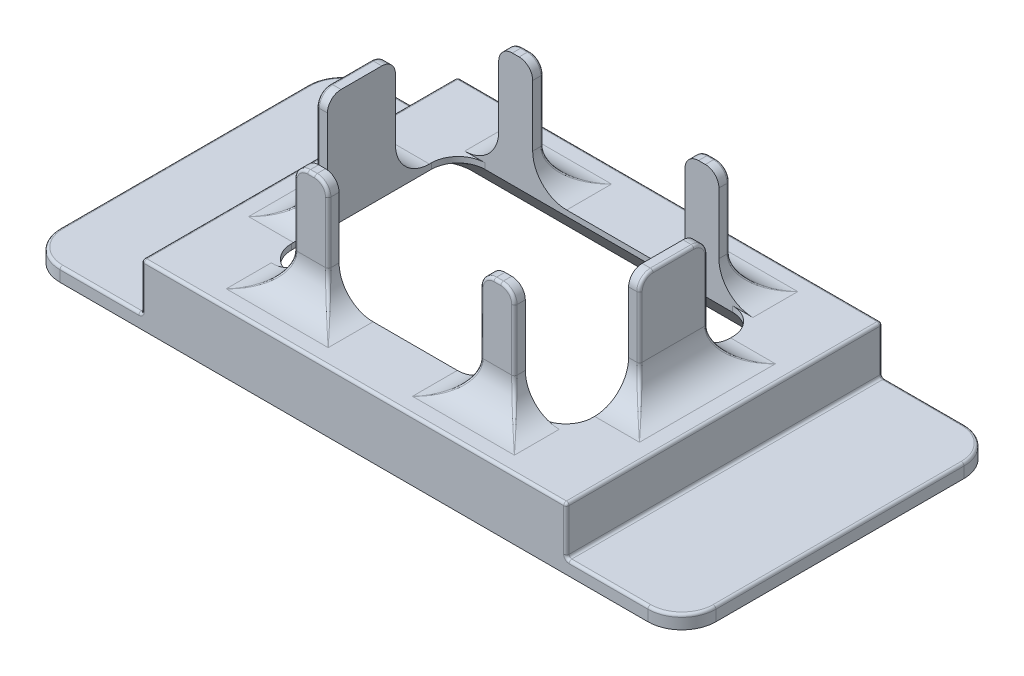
SolidWorks part; units mm, degrees
ref_plane "Front Plane" through (0, 0, 0) normal (0, 0, 1) x (1, 0, 0)
ref_plane "Top Plane" through (0, 0, 0) normal (0, 1, 0) x (1, 0, 0)
ref_plane "Right Plane" through (0, 0, 0) normal (1, 0, 0) x (0, 0, -1)
sketch "Sketch1" plane through (0, 0, 0) normal (0, 1, 0) x (1, 0, 0)
  line L1 (0, 0) -> (117.475, 0) construction
  line L2 (0, 0) -> (0, 53.975) construction
  line L3 (0, 53.975) -> (117.475, 53.975) construction
  line L4 (117.475, 0) -> (117.475, 53.975) construction
  line L13 (-2.54, -2.54) -> (120.015, -2.54)
  line L14 (-2.54, -2.54) -> (-2.54, 56.515)
  line L15 (-2.54, 56.515) -> (120.015, 56.515)
  line L16 (120.015, -2.54) -> (120.015, 56.515)
  point P5 (0, 0)
  point P6 (0, 0)
  dimension "D1" = 53.975
  dimension "D2" = 117.475
extrude "Boss-Extrude1" add sketch "Sketch1" along normal blind 2.54
sketch "Sketch4" plane through (0, 2.54, 0) normal (0, 1, 0) x (1, 0, 0)
  line L0 (120.015, 56.515) -> (-2.54, 56.515) construction
  line L1 (19.05, 56.515) -> (98.425, 56.515)
  line L2 (19.05, 56.515) -> (19.05, -2.54)
  line L3 (19.05, -2.54) -> (98.425, -2.54)
  line L4 (98.425, 56.515) -> (98.425, -2.54)
  line L5 (-2.54, -2.54) -> (120.015, -2.54) construction
  line L6 (19.05, 31.2477) -> (-2.54, 31.2477) construction
  line L7 (-2.54, 56.515) -> (-2.54, -2.54) construction
  line L8 (98.425, 33.5553) -> (120.015, 33.5553) construction
  line L9 (120.015, -2.54) -> (120.015, 56.515) construction
ref_plane "Plane1" through (0, 8.89, 0) normal (0, 1, 0) x (1, 0, 0)
extrude "Boss-Extrude4" add sketch "Sketch4" along normal blind 8.89
sketch "Sketch2" plane through (0, 11.43, 0) normal (0, 1, 0) x (1, 0, 0)
  line L0 (36.7804, 44.1713) -> (80.6946, 44.1713)
  line L17 (36.7804, 39.398) -> (80.6946, 39.398) construction
  line L18 (36.7804, 39.398) -> (36.7804, 14.577) construction
  line L19 (36.7804, 14.577) -> (80.6946, 14.577) construction
  line L20 (80.6946, 39.398) -> (80.6946, 14.577) construction
  line L22 (85.4678, 39.398) -> (85.4678, 14.577)
  line L23 (80.6946, 9.8037) -> (36.7804, 9.8037)
  line L25 (32.0072, 39.398) -> (32.0072, 14.577)
  line L28 (46.4988, 45.1675) -> (46.4988, 56.515) construction
  line L30 (19.05, 56.515) -> (98.425, 56.515) construction
  line L32 (46.0263, 8.8075) -> (46.0263, -2.54) construction
  line L34 (19.05, -2.54) -> (98.425, -2.54) construction
  line L39 (30.4575, 31.1755) -> (-2.54, 31.1755) construction
  line L40 (-2.54, 56.515) -> (-2.54, -2.54) construction
  line L41 (87.0175, 32.6858) -> (120.015, 32.6858) construction
  line L42 (120.015, -2.54) -> (120.015, 56.515) construction
  line L43 (36.7804, 14.577) -> (80.6946, 39.398) construction
  line L44 (36.7804, 39.398) -> (80.6946, 14.577) construction
  arc A4 (36.7804, 44.1713) -> (32.0072, 39.398) centre (36.7804, 39.398) ccw
  arc A5 (32.0072, 14.577) -> (36.7804, 9.8037) centre (36.7804, 14.577) ccw
  arc A6 (80.6946, 9.8037) -> (85.4678, 14.577) centre (80.6946, 14.577) ccw
  arc A7 (85.4678, 39.398) -> (80.6946, 44.1713) centre (80.6946, 39.398) ccw
sketch "Sketch6" plane through (0, 0, 0) normal (0, 1, 0) x (1, 0, 0)
  line L0 (24.2375, 53.9875) -> (93.2375, 53.9875)
  line L1 (24.2375, 46.4875) -> (93.2375, 46.4875) construction
  line L2 (24.2375, 46.4875) -> (24.2375, 7.4875) construction
  line L3 (24.2375, 7.4875) -> (93.2375, 7.4875) construction
  line L4 (93.2375, 46.4875) -> (93.2375, 7.4875) construction
  line L5 (100.7375, 46.4875) -> (100.7375, 7.4875)
  line L6 (93.2375, -0.0125) -> (24.2375, -0.0125)
  line L7 (16.7375, 46.4875) -> (16.7375, 7.4875)
  line L8 (24.2375, 7.4875) -> (93.2375, 46.4875) construction
  line L9 (24.2375, 46.4875) -> (93.2375, 7.4875) construction
  line L10 (48.6453, 53.9875) -> (48.6453, 56.515) construction
  line L11 (19.05, 56.515) -> (98.425, 56.515) construction
  line L12 (47.9303, -0.0125) -> (47.9303, -2.54) construction
  line L13 (19.05, -2.54) -> (98.425, -2.54) construction
  line L14 (16.7375, 28.6337) -> (-2.54, 28.6337) construction
  line L15 (-2.54, 56.515) -> (-2.54, -2.54) construction
  line L16 (100.7375, 24.0221) -> (120.015, 24.0221) construction
  line L17 (120.015, -2.54) -> (120.015, 56.515) construction
  arc A0 (24.2375, 53.9875) -> (16.7375, 46.4875) centre (24.2375, 46.4875) ccw
  arc A1 (16.7375, 7.4875) -> (24.2375, -0.0125) centre (24.2375, 7.4875) ccw
  arc A2 (93.2375, -0.0125) -> (100.7375, 7.4875) centre (93.2375, 7.4875) ccw
  arc A3 (100.7375, 46.4875) -> (93.2375, 53.9875) centre (93.2375, 46.4875) ccw
  dimension "D3" = 7.5
  dimension "D1" = 39
  dimension "D2" = 69
loft "Cut-Loft2" cut profiles "Sketch2", "Sketch6"
sketch "Sketch8" plane through (0, 11.43, 0) normal (0, 1, 0) x (1, 0, 0)
  line L0 (35.6248, 45.0757) -> (81.8502, 45.0757)
  line L1 (35.6248, 40.0512) -> (81.8502, 40.0512) construction
  line L2 (35.6248, 40.0512) -> (35.6248, 13.9238) construction
  line L3 (35.6248, 13.9238) -> (81.8502, 13.9238) construction
  line L4 (81.8502, 40.0512) -> (81.8502, 13.9238) construction
  line L5 (86.8747, 40.0512) -> (86.8747, 13.9238)
  line L6 (81.8502, 8.8993) -> (35.6248, 8.8993)
  line L7 (30.6003, 40.0512) -> (30.6003, 13.9238)
  line L8 (35.6248, 13.9238) -> (81.8502, 40.0512) construction
  line L9 (35.6248, 40.0512) -> (81.8502, 13.9238) construction
  line L10 (53.9536, 45.0757) -> (53.9536, 56.515) construction
  line L11 (98.425, 56.515) -> (19.05, 56.515) construction
  line L12 (53.9536, 8.8993) -> (53.9536, -2.54) construction
  line L13 (19.05, -2.54) -> (98.425, -2.54) construction
  line L14 (30.6003, 28.5496) -> (-2.54, 28.5496) construction
  line L16 (-2.54, 56.515) -> (-2.54, -2.54) construction
  line L18 (86.8747, 29.6235) -> (120.015, 29.6235) construction
  line L19 (120.015, -2.54) -> (120.015, 56.515) construction
  arc A0 (35.6248, 45.0757) -> (30.6003, 40.0512) centre (35.6248, 40.0512) ccw
  arc A1 (30.6003, 13.9238) -> (35.6248, 8.8993) centre (35.6248, 13.9238) ccw
  arc A2 (81.8502, 8.8993) -> (86.8747, 13.9238) centre (81.8502, 13.9238) ccw
  arc A3 (86.8747, 40.0512) -> (81.8502, 45.0757) centre (81.8502, 40.0512) ccw
  dimension "D2" = 5.0245
  dimension "D1" = 26.1274
  dimension "D3" = 46.2254
extrude "Cut-Extrude2" cut sketch "Sketch8" against normal blind 8.89
sketch "Sketch9" plane through (0, 11.43, 0) normal (0, 1, 0) x (1, 0, 0)
  line L0 (30.6003, 40.0512) -> (30.6003, 13.9238) construction
  line L1 (30.6003, 33.3375) -> (28.5683, 33.3375)
  line L2 (30.6003, 33.3375) -> (30.6003, 20.6375)
  line L3 (30.6003, 20.6375) -> (28.5683, 20.6375)
  line L4 (28.5683, 33.3375) -> (28.5683, 20.6375)
  line L5 (35.6248, 8.8993) -> (81.8502, 8.8993) construction
  line L6 (38.1648, 8.8993) -> (44.5148, 8.8993)
  line L7 (38.1648, 8.8993) -> (38.1648, 6.8673)
  line L8 (38.1648, 6.8673) -> (44.5148, 6.8673)
  line L9 (44.5148, 8.8993) -> (44.5148, 6.8673)
  line L10 (86.8747, 13.9238) -> (86.8747, 40.0512) construction
  line L11 (79.3102, 8.8993) -> (72.9602, 8.8993)
  line L12 (79.3102, 8.8993) -> (79.3102, 6.8673)
  line L13 (79.3102, 6.8673) -> (72.9602, 6.8673)
  line L14 (72.9602, 8.8993) -> (72.9602, 6.8673)
  line L15 (86.8747, 33.3375) -> (88.9067, 33.3375)
  line L16 (86.8747, 33.3375) -> (86.8747, 20.6375)
  line L17 (86.8747, 20.6375) -> (88.9067, 20.6375)
  line L18 (88.9067, 33.3375) -> (88.9067, 20.6375)
  line L19 (81.8502, 45.0757) -> (35.6248, 45.0757) construction
  line L20 (38.1648, 45.0757) -> (44.5148, 45.0757)
  line L21 (38.1648, 45.0757) -> (38.1648, 47.1077)
  line L22 (38.1648, 47.1077) -> (44.5148, 47.1077)
  line L23 (44.5148, 45.0757) -> (44.5148, 47.1077)
  line L24 (30.6003, 20.6375) -> (30.6003, 13.9238) construction
  line L25 (72.9602, 45.0757) -> (79.3102, 45.0757)
  line L26 (72.9602, 45.0757) -> (72.9602, 47.1077)
  line L27 (72.9602, 47.1077) -> (79.3102, 47.1077)
  line L28 (79.3102, 45.0757) -> (79.3102, 47.1077)
  line L29 (30.6003, 33.3375) -> (30.6003, 40.0512) construction
  point P35 (79.3102, 46.0917)
  dimension "D1" = 6.35
  dimension "D2" = 6.35
  dimension "D3" = 2.54
  dimension "D4" = 2.54
  dimension "D5" = 12.7
  dimension "D6" = 2.032
extrude "Boss-Extrude5" add sketch "Sketch9" along normal blind 20.32
fillet "Fillet1" radius 6.35 1 edges at (44.5148, 11.43, -7.8833)
fillet "Fillet2" radius 6.35 1 edges at (72.9602, 11.43, -7.8833)
fillet "Fillet3" radius 6.35 1 edges at (87.8907, 11.43, -20.6375)
fillet "Fillet4" radius 6.35 1 edges at (87.8907, 11.43, -33.3375)
fillet "Fillet5" radius 6.35 1 edges at (72.9602, 11.43, -46.0917)
fillet "Fillet6" radius 6.35 1 edges at (44.5148, 11.43, -46.0917)
fillet "Fillet7" radius 6.35 1 edges at (29.5843, 11.43, -33.3375)
fillet "Fillet8" radius 6.35 1 edges at (29.5843, 11.43, -20.6375)
fillet "Fillet9" radius 6.35 1 edges at (79.3102, 11.43, -7.8833)
fillet "Fillet10" radius 6.35 1 edges at (38.1648, 11.43, -7.8833)
fillet "Fillet11" radius 6.35 1 edges at (38.1648, 11.43, -46.0917)
fillet "Fillet12" radius 6.35 3 edges at (41.3398, 11.43, -6.8673) (46.3747, 13.2899, -6.8673) (36.3049, 13.2899, -6.8673)
fillet "Fillet13" radius 6.35 3 edges at (76.1352, 11.43, -6.8673) (71.1003, 13.2899, -6.8673) (81.1701, 13.2899, -6.8673)
fillet "Fillet14" radius 6.35 3 edges at (88.9067, 11.43, -26.9875) (88.9067, 13.2899, -18.7776) (88.9067, 13.2899, -35.1974)
fillet "Fillet16" radius 6.35 1 edges at (79.3102, 11.43, -46.0917)
fillet "Fillet17" radius 6.35 3 edges at (76.1352, 11.43, -47.1077) (71.1003, 13.2899, -47.1077) (81.1701, 13.2899, -47.1077)
fillet "Fillet18" radius 6.35 3 edges at (41.3398, 11.43, -47.1077) (46.3747, 13.2899, -47.1077) (36.3049, 13.2899, -47.1077)
fillet "Fillet19" radius 6.35 3 edges at (28.5683, 11.43, -26.9875) (28.5683, 13.2899, -35.1974) (28.5683, 13.2899, -18.7776)
fillet "Fillet20" radius 6.35 1 edges at (-2.54, 1.27, -56.515)
fillet "Fillet21" radius 6.35 1 edges at (-2.54, 1.27, 2.54)
fillet "Fillet22" radius 6.35 1 edges at (120.015, 1.27, 2.54)
fillet "Fillet23" radius 6.35 1 edges at (120.015, 1.27, -56.515)
fillet "Fillet24" radius 2.54 1 edges at (29.5843, 31.75, -20.6375)
fillet "Fillet25" radius 2.54 1 edges at (29.5843, 31.75, -33.3375)
fillet "Fillet26" radius 2.54 1 edges at (38.1648, 31.75, -7.8833)
fillet "Fillet27" radius 2.54 1 edges at (44.5148, 31.75, -7.8833)
fillet "Fillet28" radius 2.54 1 edges at (72.9602, 31.75, -7.8833)
fillet "Fillet29" radius 2.54 1 edges at (79.3102, 31.75, -7.8833)
fillet "Fillet30" radius 2.54 1 edges at (87.8907, 31.75, -20.6375)
fillet "Fillet31" radius 2.54 1 edges at (87.8907, 31.75, -33.3375)
fillet "Fillet32" radius 2.54 1 edges at (79.3102, 31.75, -46.0917)
fillet "Fillet33" radius 2.54 1 edges at (72.9602, 31.75, -46.0917)
fillet "Fillet34" radius 2.54 1 edges at (44.5148, 31.75, -46.0917)
fillet "Fillet35" radius 2.54 1 edges at (38.1648, 31.75, -46.0917)
fillet "Fillet36" radius 0.508 62 edges at (106.045, 2.54, 2.54) (11.43, 2.54, -56.515) (19.05, 2.54, -26.9875) (19.05, 6.985, -56.515) (19.05, 6.985, 2.54) (98.425, 2.54, -26.9875) (98.425, 6.985, 2.54) (98.425, 6.985, -56.515) (19.05, 11.43, -26.9875) (58.7375, 11.43, 2.54) (98.425, 11.43, -26.9875) (58.7375, 11.43, -56.515) (36.3049, 13.2899, -5.0074) (46.3747, 13.2899, -5.0074) (71.1003, 13.2899, -5.0074) (81.1701, 13.2899, -5.0074) (90.7666, 13.2899, -18.7776) (90.7666, 13.2899, -35.1974) (81.1701, 13.2899, -48.9676) (71.1003, 13.2899, -48.9676) (46.3747, 13.2899, -48.9676) (36.3049, 13.2899, -48.9676) (26.7084, 13.2899, -35.1974) (26.7084, 13.2899, -18.7776) (-2.54, 2.54, -26.9875) (-0.6801, 2.54, -54.6551) (11.43, 2.54, 2.54) (-0.6801, 2.54, 0.6801) (120.015, 2.54, -26.9875) (118.1551, 2.54, 0.6801) (106.045, 2.54, -56.515) (118.1551, 2.54, -54.6551) (28.5683, 23.495, -20.6375) (28.5683, 31.0061, -21.3814) (28.5683, 31.75, -26.9875) (28.5683, 23.495, -33.3375) (28.5683, 31.0061, -32.5936) (41.3398, 31.75, -6.8673) (38.1648, 23.495, -6.8673) (38.9088, 31.0061, -6.8673) (44.5148, 23.495, -6.8673) (43.7709, 31.0061, -6.8673) (76.1352, 31.75, -6.8673) (72.9602, 23.495, -6.8673) (73.7041, 31.0061, -6.8673) (79.3102, 23.495, -6.8673) (78.5662, 31.0061, -6.8673) (88.9067, 31.75, -26.9875) (88.9067, 23.495, -20.6375) (88.9067, 31.0061, -21.3814) (88.9067, 23.495, -33.3375) (88.9067, 31.0061, -32.5936) (76.1352, 31.75, -47.1077) (79.3102, 23.495, -47.1077) (78.5662, 31.0061, -47.1077) (72.9602, 23.495, -47.1077) (73.7041, 31.0061, -47.1077) (41.3398, 31.75, -47.1077) (44.5148, 23.495, -47.1077) (43.7709, 31.0061, -47.1077) (38.1648, 23.495, -47.1077) (38.9088, 31.0061, -47.1077)
